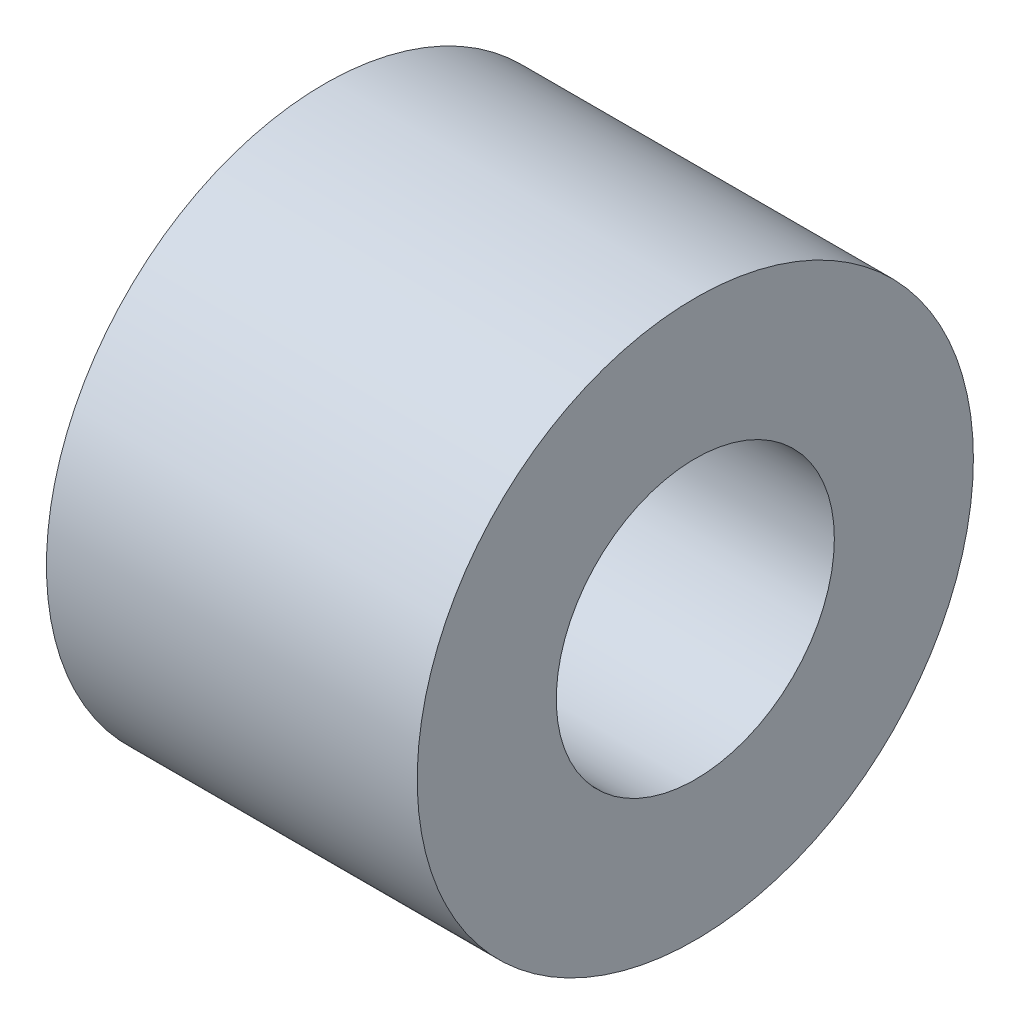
SolidWorks part; units mm, degrees
ref_plane "Front Plane" through (0, 0, 0) normal (0, 0, 1) x (1, 0, 0)
ref_plane "Top Plane" through (0, 0, 0) normal (0, 1, 0) x (1, 0, 0)
ref_plane "Right Plane" through (0, 0, 0) normal (1, 0, 0) x (0, 0, -1)
sketch "Sketch1" plane through (0, 0, 0) normal (1, 0, 0) x (0, 0, -1)
  circle A0 centre (0, 0) radius 2.3812
extrude "Extrude1" add sketch "Sketch1" along normal blind 3.175
sketch "Sketch2" plane through (3.175, 0, 0) normal (1, 0, 0) x (0, 0, -1)
  circle A0 centre (0, 0) radius 1.1906
  dimension "D1" = 2.3813
extrude "Extrude2" cut sketch "Sketch2" against normal through all
